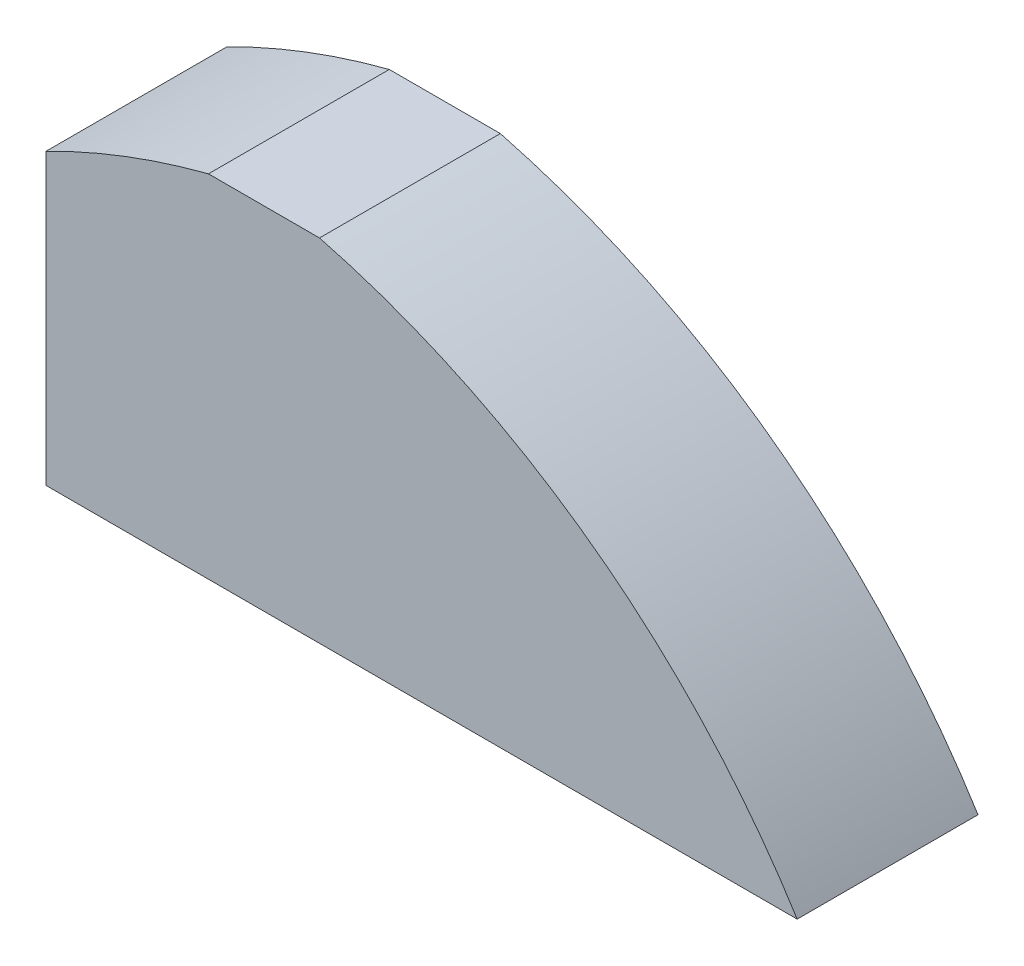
SolidWorks part; units mm, degrees
ref_plane "Alzado" through (0, 0, 0) normal (0, 0, 1) x (1, 0, 0)
ref_plane "Planta" through (0, 0, 0) normal (0, 1, 0) x (1, 0, 0)
ref_plane "Vista lateral" through (0, 0, 0) normal (1, 0, 0) x (0, 0, -1)
sketch "Croquis1" plane through (0, 0, 0) normal (0, 0, 1) x (1, 0, 0)
  line L0 (-1232.0175, 873.2011) -> (-1232.0175, 1164.0721)
  line L1 (-1262.0175, 358.2011) -> (-1262.0175, 1182.5293)
  line L2 (-799.2712, 1358.2011) -> (-482.9721, 1358.2011)
  line L3 (-795.4295, 1328.2011) -> (-486.8138, 1328.2011)
  line L5 (-1262.0175, 1182.5293) -> (-1262.0175, 358.2011)
  line L6 (-1262.0175, 358.2011) -> (877.5226, 358.2011)
  line L7 (-1232.0175, 388.2011) -> (-1232.0175, 1164.0721) construction
  line L8 (-1232.0175, 388.2011) -> (-1232.0175, 843.2011)
  line L9 (-1232.0175, 388.2011) -> (822.7212, 388.2011)
  line L10 (-1232.0175, 843.2011) -> (426.983, 843.2011)
  line L11 (-1232.0175, 873.2011) -> (392.0848, 873.2011)
  arc A0 (-1262.0175, 1182.5293) -> (-799.2712, 1358.2011) centre (-227.5597, -845.0822) cw
  arc A1 (877.5226, 358.2011) -> (-482.9721, 1358.2011) centre (-1054.6836, -845.0822) ccw
  arc A2 (822.7212, 388.2011) -> (426.983, 843.2011) centre (-1054.6836, -845.0822) ccw
  arc A3 (-1232.0175, 1164.0721) -> (-795.4295, 1328.2011) centre (-227.5597, -845.0822) cw
  arc A4 (392.0848, 873.2011) -> (-486.8138, 1328.2011) centre (-1054.6836, -845.0822) ccw
  arc A6 (822.7212, 388.2011) -> (-486.8138, 1328.2011) centre (-1054.6836, -845.0822) ccw construction
  point P1 (-1262.0175, 858.2011)
  point P2 (877.5226, 858.2011)
  point P5 (455.3288, 858.2011)
  point P6 (-1262.0175, 1358.2011)
  point P9 (877.5226, 1358.2011)
  point P19 (-1262.0175, 843.2011)
  point P20 (455.3288, 843.2011)
  point P21 (-1262.0175, 873.2011)
  point P22 (455.3288, 873.2011)
  dimension "D3" = 30
extrude "Saliente-Extruir2" add sketch "Croquis1" along normal blind 500 contours L6 A1 L2 A0 L1 A4 L11 L0 A3 L3 A2 L9 L8 L10
sketch "Croquis2" plane through (0, 0, 500) normal (0, 0, 1) x (1, 0, 0)
  line L0 (-1262.0175, 1182.5293) -> (-1262.0175, 358.2011)
  line L1 (-1262.0175, 358.2011) -> (877.5226, 358.2011)
  line L2 (-799.2712, 1358.2011) -> (-482.9721, 1358.2011)
  arc A0 (-1262.0175, 1182.5293) -> (-799.2712, 1358.2011) centre (-227.5597, -845.0822) cw
  arc A1 (-482.9721, 1358.2011) -> (877.5226, 358.2011) centre (-1054.6836, -845.0822) cw
extrude "Saliente-Extruir3" add sketch "Croquis2" along normal blind 15
